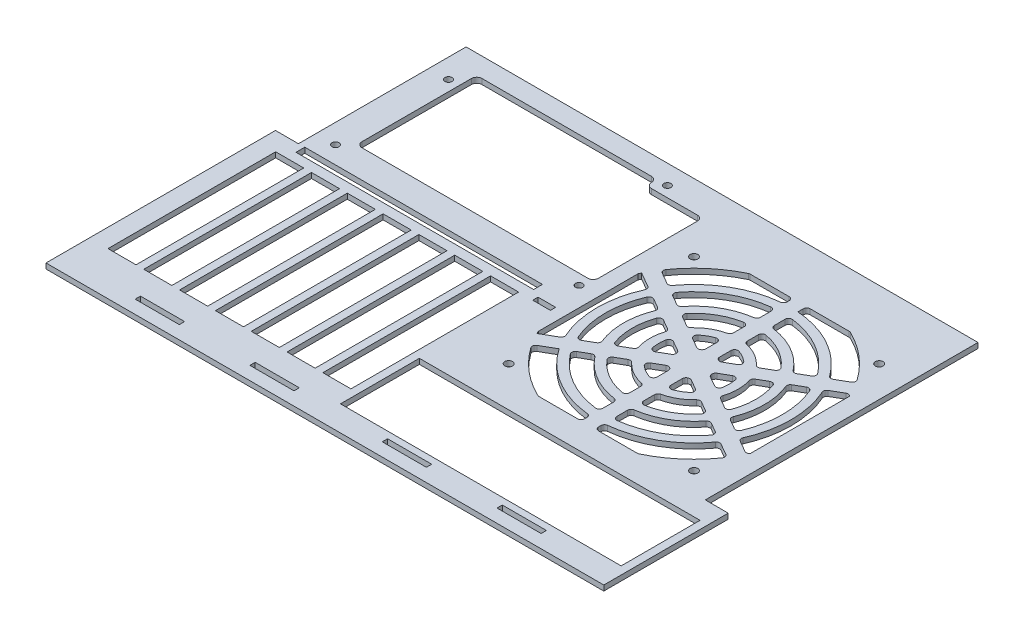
SolidWorks part; units mm, degrees
ref_plane "Front Plane" through (0, 0, 0) normal (0, 0, 1) x (1, 0, 0)
ref_plane "Top Plane" through (0, 0, 0) normal (0, 1, 0) x (1, 0, 0)
ref_plane "Right Plane" through (0, 0, 0) normal (1, 0, 0) x (0, 0, -1)
sketch "Sketch1" plane through (0, 0, 0) normal (0, 1, 0) x (1, 0, 0)
  line L0 (0, 0) -> (310, 0)
  line L1 (310, 0) -> (310, 225)
  line L2 (0, 0) -> (0, 225)
  line L3 (0, 225) -> (310, 225)
extrude "Boss-Extrude1" add sketch "Sketch1" along normal blind 3
sketch "Sketch2" plane through (0, 0, 0) normal (0, -1, 0) x (1, 0, 0)
  line L0 (0, 0) -> (0, -7.5) construction
  line L1 (0, -225) -> (0, 0) construction
  line L2 (0, -7.5) -> (40, -7.5) construction
  line L3 (40, -7.5) -> (65, -7.5) construction
  line L4 (65, -7.5) -> (105, -7.5) construction
  line L5 (270, -7.5) -> (310, -7.5) construction
  line L6 (310, 0) -> (310, -225) construction
  line L7 (105, -7.5) -> (130, -7.5) construction
  line L8 (130, -7.5) -> (180, -7.5) construction
  line L9 (180, -7.5) -> (205, -7.5) construction
  line L10 (205, -7.5) -> (245, -7.5) construction
  line L11 (245, -7.5) -> (270, -7.5) construction
  line L12 (40, -7.5) -> (65, -7.5)
  line L13 (65, -7.5) -> (65, -10.5)
  line L14 (65, -10.5) -> (40, -10.5)
  line L15 (40, -10.5) -> (40, -7.5)
  line L16 (105, -7.5) -> (130, -7.5)
  line L17 (130, -7.5) -> (130, -10.5)
  line L18 (130, -10.5) -> (105, -10.5)
  line L19 (105, -10.5) -> (105, -7.5)
  line L20 (180, -7.5) -> (205, -7.5)
  line L21 (205, -7.5) -> (205, -10.5)
  line L22 (205, -10.5) -> (180, -10.5)
  line L23 (180, -10.5) -> (180, -7.5)
  line L24 (245, -7.5) -> (245, -10.5)
  line L25 (245, -10.5) -> (270, -10.5)
  line L26 (270, -10.5) -> (270, -7.5)
  line L27 (270, -7.5) -> (245, -7.5)
  dimension "D1" = 40
  dimension "D2" = 40
  dimension "D3" = 25
  dimension "D4" = 25
  dimension "D5" = 50
  dimension "D6" = 25
  dimension "D7" = 40
  dimension "D8" = 25
extrude "Cut-Extrude1" cut sketch "Sketch2" against normal blind 3
sketch "Sketch4" plane through (0, 0, 0) normal (0, -1, 0) x (1, 0, 0)
  line L0 (270, -10.5) -> (310, -10.5) construction
  line L1 (310, 0) -> (310, -225) construction
  line L7 (310, -10.5) -> (310, -70.5) construction
  line L8 (310, -70.5) -> (300, -70.5)
  line L9 (300, -70.5) -> (300, -225)
  line L10 (310, -225) -> (0, -225) construction
  line L11 (300, -225) -> (310, -225)
  line L12 (310, -225) -> (310, -70.5)
extrude "Cut-Extrude3" cut sketch "Sketch4" against normal blind 10
sketch "Sketch5" plane through (310, 0, 0) normal (1, 0, 0) x (0, 0, -1)
  line L4 (0, 3) -> (0, 0)
  line L10 (0, 0) -> (70.5, 0)
  line L11 (70.5, 0) -> (70.5, 3)
  line L12 (70.5, 3) -> (0, 3)
extrude "Boss-Extrude2" add sketch "Sketch5" along normal blind 3
sketch "Sketch6" plane through (0, 3, 0) normal (0, 1, 0) x (1, 0, 0)
  line L0 (306, 16.5) -> (306, 10.5) construction
  line L1 (306, 10.5) -> (306, 0) construction
  line L2 (311, 16.5) -> (313, 16.5) construction
  line L3 (27.8, 24.6) -> (23.41, 24.6) construction
  line L4 (311, 16.5) -> (306, 16.5) construction
  line L5 (306, 16.5) -> (306, 14.29) construction
  line L6 (306, 14.29) -> (308.54, 14.29) construction
  line L7 (308.54, 14.29) -> (308.54, 58.99)
  line L8 (308.54, 58.99) -> (149.54, 58.99)
  line L9 (149.54, 58.99) -> (149.54, 14.29)
  line L10 (149.54, 14.29) -> (308.54, 14.29)
  line L11 (306, 16.5) -> (306, 18.1) construction
  line L12 (306, 18.1) -> (6, 18.1) construction
  line L13 (23.41, 24.6) -> (7.51, 24.6)
  line L14 (149.54, 58.99) -> (145.15, 58.99) construction
  line L15 (145.15, 18.1) -> (145.15, 24.6) construction
  line L16 (145.15, 24.6) -> (145.15, 119.6)
  line L17 (145.15, 119.6) -> (129.25, 119.6)
  line L18 (129.25, 119.6) -> (129.25, 24.6)
  line L19 (129.25, 24.6) -> (145.15, 24.6)
  line L20 (129.25, 24.6) -> (124.86, 24.6) construction
  line L21 (124.86, 24.6) -> (108.96, 24.6)
  line L22 (108.96, 24.6) -> (104.57, 24.6) construction
  line L23 (104.57, 24.6) -> (88.67, 24.6)
  line L24 (88.67, 24.6) -> (84.28, 24.6) construction
  line L25 (84.28, 24.6) -> (68.38, 24.6)
  line L26 (68.38, 24.6) -> (63.99, 24.6) construction
  line L27 (63.99, 24.6) -> (48.09, 24.6)
  line L28 (124.86, 24.6) -> (124.86, 119.6)
  line L29 (124.86, 119.6) -> (108.96, 119.6)
  line L30 (108.96, 119.6) -> (108.96, 24.6)
  line L31 (104.57, 24.6) -> (104.57, 119.6)
  line L32 (104.57, 119.6) -> (88.67, 119.6)
  line L33 (88.67, 119.6) -> (88.67, 24.6)
  line L34 (84.28, 24.6) -> (84.28, 119.6)
  line L35 (84.28, 119.6) -> (68.38, 119.6)
  line L36 (68.38, 119.6) -> (68.38, 24.6)
  line L37 (63.99, 24.6) -> (63.99, 119.6)
  line L38 (63.99, 119.6) -> (48.09, 119.6)
  line L39 (48.09, 119.6) -> (48.09, 24.6)
  line L40 (48.09, 24.6) -> (43.7, 24.6) construction
  line L41 (43.7, 24.6) -> (27.8, 24.6)
  line L42 (43.7, 24.6) -> (43.7, 119.6)
  line L43 (43.7, 119.6) -> (27.8, 119.6)
  line L44 (27.8, 119.6) -> (27.8, 24.6)
  line L45 (0, 0) -> (313, 0) construction
  line L46 (7.51, 24.6) -> (7.51, 119.6)
  line L47 (7.51, 119.6) -> (23.41, 119.6)
  line L48 (313, 70.5) -> (313, 0) construction
  line L49 (313, 16.5) -> (313, 0) construction
  line L50 (23.41, 119.6) -> (23.41, 24.6)
  line L51 (270, 10.5) -> (306, 10.5) construction
  dimension "D2" = 5
  dimension "D3" = 15.9
  dimension "D4" = 4.39
  dimension "D5" = 15.9
  dimension "D6" = 4.39
  dimension "D7" = 15.9
  dimension "D8" = 4.39
  dimension "D9" = 15.9
  dimension "D10" = 4.39
  dimension "D11" = 15.9
  dimension "D12" = 4.39
  dimension "D13" = 15.9
  dimension "D14" = 4.39
  dimension "D15" = 159
  dimension "D16" = 2.54
  dimension "D17" = 1.6
  dimension "D18" = 4.39
  dimension "D19" = 2
extrude "Cut-Extrude4" cut sketch "Sketch6" against normal blind 3
sketch "Sketch7" plane through (0, 0, 0) normal (0, -1, 0) x (1, 0, 0)
  line L0 (0, 0) -> (0, -130) construction
  line L1 (0, -225) -> (0, 0) construction
  line L2 (0, -130) -> (-3, -130)
  line L3 (-3, -130) -> (-3, 0)
  line L4 (-3, 0) -> (0, 0)
  line L5 (0, 0) -> (0, -130)
extrude "Boss-Extrude3" add sketch "Sketch7" against normal blind 3
sketch "Sketch8" plane through (0, 0, 0) normal (0, -1, 0) x (1, 0, 0)
  line L0 (0, -130) -> (10, -130)
  line L1 (10, -130) -> (10, -225)
  line L2 (300, -225) -> (0, -225) construction
  line L3 (10, -225) -> (0, -225)
  line L4 (0, -225) -> (0, -130)
extrude "Cut-Extrude5" cut sketch "Sketch8" against normal blind 3
sketch "Sketch9" plane through (0, 0, 0) normal (0, -1, 0) x (1, 0, 0)
  line L0 (10, -177.5) -> (15, -177.5) construction
  line L1 (10, -225) -> (10, -130) construction
  line L2 (165, -225) -> (165, -220) construction
  line L3 (300, -225) -> (10, -225) construction
  line L4 (165, -220) -> (15, -220) construction
  line L5 (15, -220) -> (15, -134) construction
  line L6 (15, -134) -> (165, -134) construction
  line L7 (165, -134) -> (165, -220) construction
  line L8 (15, -220) -> (21, -220) construction
  line L9 (21, -220) -> (21, -204) construction
  line L10 (21, -204) -> (21, -140) construction
  line L11 (159, -140) -> (21, -140) construction
  line L12 (21, -220) -> (135, -220) construction
  line L13 (135, -220) -> (135, -214) construction
  line L14 (90, -140) -> (90, -146) construction
  line L15 (21, -172) -> (27, -172) construction
  line L16 (90, -220) -> (90, -214) construction
  line L17 (135, -214) -> (129, -214) construction
  line L18 (135, -214) -> (135, -208) construction
  line L19 (90, -146) -> (27, -146)
  line L20 (27, -146) -> (27, -214)
  line L21 (27, -214) -> (129, -214)
  line L22 (129, -214) -> (129, -208)
  line L23 (165, -181.7713) -> (161, -181.7713) construction
  line L24 (161, -181.7713) -> (151.3672, -181.7713) construction
  line L25 (129, -208) -> (161, -208)
  line L26 (161, -208) -> (161, -146)
  line L27 (161, -146) -> (90, -146)
  circle A0 centre (21, -204) radius 2
  circle A1 centre (21, -140) radius 2
  circle A2 centre (159, -140) radius 2
  circle A3 centre (135, -214) radius 2
  dimension "D1" = 5
extrude "Cut-Extrude6" cut sketch "Sketch9" against normal blind 3
fillet "Fillet1" radius 3 6 edges at (27, 1.5, -146) (27, 1.5, -214) (161, 1.5, -208) (129, 1.5, -208) (129, 1.5, -214) (161, 1.5, -146)
sketch "Sketch10" plane through (0, 0, 0) normal (0, -1, 0) x (1, 0, 0)
  line L0 (300, -147.75) -> (290, -147.75) construction
  line L1 (300, -70.5) -> (300, -225) construction
  line L2 (235.3769, -225) -> (235.3769, -220) construction
  line L3 (300, -225) -> (10, -225) construction
  line L4 (240.7859, -58.99) -> (240.7859, -74.1135) construction
  line L5 (230, -123.99) -> (230, -125.4683)
  line L6 (308.54, -58.99) -> (149.54, -58.99) construction
  line L8 (290, -74.1135) -> (170, -74.1135) construction
  line L10 (290, -74.1135) -> (170, -194.1135) construction
  line L12 (290, -74.1135) -> (290, -81.6135) construction
  line L13 (290, -81.6135) -> (282.5, -81.6135) construction
  line L14 (290, -194.1135) -> (282.5006, -194.016) construction
  line L15 (282.5006, -194.016) -> (282.5006, -186.516) construction
  line L16 (170, -194.1135) -> (177.5, -194.1135) construction
  line L17 (177.5, -194.1135) -> (177.5, -186.6135) construction
  line L18 (170, -74.1135) -> (170, -81.6135) construction
  line L19 (170, -81.6135) -> (177.5, -81.6135) construction
  line L20 (282.5, -81.6135) -> (177.5, -186.6135) construction
  line L22 (230, -125.4683) -> (233.972, -125.4683)
  line L23 (230, -125.4683) -> (226.028, -125.4683)
  line L24 (226.028, -125.4683) -> (226.028, -67.9265)
  line L25 (233.972, -125.4683) -> (233.972, -67.9265)
  line L26 (233.972, -67.9265) -> (226.028, -67.9265)
  line L27 (239.4729, -133.2307) -> (289.3055, -104.4598)
  line L28 (289.3055, -104.4598) -> (285.3336, -97.5802)
  line L29 (235.501, -126.3511) -> (285.3336, -97.5802)
  line L30 (237.4869, -129.7909) -> (239.4729, -133.2307)
  line L31 (237.4869, -129.7909) -> (235.501, -126.3511)
  line L32 (235.501, -141.8759) -> (285.3336, -170.6467)
  line L33 (285.3336, -170.6467) -> (289.3055, -163.7671)
  line L34 (239.4729, -134.9962) -> (289.3055, -163.7671)
  line L35 (237.4869, -138.436) -> (235.501, -141.8759)
  line L36 (237.4869, -138.436) -> (239.4729, -134.9962)
  line L37 (226.028, -142.7586) -> (226.028, -200.3004)
  line L38 (226.028, -200.3004) -> (233.972, -200.3004)
  line L39 (233.972, -142.7586) -> (233.972, -200.3004)
  line L40 (230, -142.7586) -> (226.028, -142.7586)
  line L41 (230, -142.7586) -> (233.972, -142.7586)
  line L42 (220.5271, -134.9962) -> (170.6945, -163.7671)
  line L43 (170.6945, -163.7671) -> (174.6664, -170.6467)
  line L44 (224.499, -141.8759) -> (174.6664, -170.6467)
  line L45 (222.5131, -138.436) -> (220.5271, -134.9962)
  line L46 (222.5131, -138.436) -> (224.499, -141.8759)
  line L47 (224.499, -126.3511) -> (174.6664, -97.5802)
  line L48 (174.6664, -97.5802) -> (170.6945, -104.4598)
  line L49 (220.5271, -133.2307) -> (170.6945, -104.4598)
  line L50 (222.5131, -129.7909) -> (224.499, -126.3511)
  line L51 (222.5131, -129.7909) -> (220.5271, -133.2307)
  line L52 (290, -105.8914) -> (290, -162.3355)
  line L53 (258.2221, -74.1135) -> (201.7779, -74.1135)
  line L54 (170, -105.8914) -> (170, -162.3355)
  line L55 (258.7815, -193.99) -> (199.2185, -193.99)
  line L56 (170, -74.1135) -> (290, -194.1135) construction
  circle A0 centre (282.5, -81.6135) radius 2.2
  circle A1 centre (282.5006, -186.516) radius 2.2
  circle A2 centre (177.5, -186.6135) radius 2.2
  circle A3 centre (177.5, -81.6135) radius 2.2
  circle A4 centre (230, -134.1135) radius 10.1235
  circle A6 centre (230, -134.1135) radius 20
  circle A7 centre (230, -134.1135) radius 25
  circle A8 centre (230, -134.1135) radius 35
  circle A9 centre (230, -134.1135) radius 40
  circle A10 centre (230, -134.1135) radius 50
  circle A12 centre (230, -134.1135) radius 55
  circle A13 centre (230, -134.1135) radius 66.306
  point P71 (230, -134.1135)
  dimension "D4" = 6
  dimension "D1" = 10
  dimension "D2" = 120
  dimension "D3" = 120
  dimension "D5" = 120
  dimension "D6" = 120
  dimension "D7" = 120
extrude "Cut-Extrude7" cut sketch "Sketch10" against normal blind 10 contours A0 | A3 | L34 A13 L52 L27 A12 | L29 A13 L53 L25 A12 | L53 A13 L47 A12 L24 | L49 A13 L54 L42 A12 | L44 A13 L55 L37 A12 | L55 A13 L32 A12 L39 | L34 A10 L27 A9 | L29 A10 L25 A9 | L24 A10 L47 A9 | L49 A10 L42 A9 | L44 A10 L37 A9 | L39 A10 L32 A9 | L34 A8 L27 A7 | L39 A8 L32 A7 | L44 A8 L37 A7 | L49 A8 L42 A7 | L24 A8 L47 A7 | L29 A8 L25 A7 | L29 A6 L25 A4 | L34 A6 L27 A4 | L39 A6 L32 A4 | L44 A6 L37 A4 | L49 A6 L42 A4 | L24 A6 L47 A4 | A2 | A1
fillet "Fillet2" radius 2 98 edges at (184.479, 1.5, -164.9815) (197.5162, 1.5, -157.4544) (210.6103, 1.5, -149.8945) (226.028, 1.5, -158.7959) (226.028, 1.5, -173.9158) (226.028, 1.5, -188.9698) (174.6664, 1.5, -170.6467) (188.8216, 1.5, -162.4743) (201.8709, 1.5, -154.9402) (215.0105, 1.5, -147.3541) (226.028, 1.5, -153.7151) (226.028, 1.5, -168.8873) (226.028, 1.5, -183.9554) (226.028, 1.5, -193.99) (201.5169, 1.5, -193.99) (258.4831, 1.5, -193.99) (184.8496, 1.5, -155.5946) (197.8989, 1.5, -148.0606) (211.0385, 1.5, -140.4744) (193.5442, 1.5, -150.5748) (206.6384, 1.5, -143.0149) (180.507, 1.5, -158.1018) (184.8496, 1.5, -112.6323) (197.8989, 1.5, -120.1663) (211.0385, 1.5, -127.7525) (206.6384, 1.5, -125.212) (193.5442, 1.5, -117.6521) (180.507, 1.5, -110.1251) (226.028, 1.5, -99.3396) (226.028, 1.5, -84.2715) (226.028, 1.5, -74.1135) (201.8709, 1.5, -113.2867) (188.8216, 1.5, -105.7526) (201.7779, 1.5, -74.1135) (258.2221, 1.5, -74.1135) (174.6664, 1.5, -97.5802) (233.972, 1.5, -173.9158) (233.972, 1.5, -168.8873) (233.972, 1.5, -183.9554) (233.972, 1.5, -193.99) (258.1291, 1.5, -154.9402) (271.1784, 1.5, -162.4743) (285.3336, 1.5, -170.6467) (275.521, 1.5, -164.9815) (262.4838, 1.5, -157.4544) (249.3897, 1.5, -149.8945) (233.972, 1.5, -158.7959) (233.972, 1.5, -143.4252) (236.0782, 1.5, -142.2091) (223.9218, 1.5, -142.2091) (226.028, 1.5, -143.4252) (219.9499, 1.5, -132.8974) (219.9499, 1.5, -135.3295) (226.028, 1.5, -124.8017) (223.9218, 1.5, -126.0178) (210.6103, 1.5, -118.3324) (197.5162, 1.5, -110.7725) (226.028, 1.5, -79.2571) (226.028, 1.5, -94.3111) (226.028, 1.5, -109.431) (266.4558, 1.5, -150.5748) (279.493, 1.5, -158.1018) (290, 1.5, -162.3355) (290, 1.5, -105.8914) (289.3055, 1.5, -163.7671) (275.1504, 1.5, -155.5946) (262.1011, 1.5, -148.0606) (248.9615, 1.5, -140.4744) (248.9615, 1.5, -127.7525) (253.3616, 1.5, -143.0149) (240.0501, 1.5, -135.3295) (240.0501, 1.5, -132.8974) (253.3616, 1.5, -125.212) (262.1011, 1.5, -120.1663) (275.1504, 1.5, -112.6323) (266.4558, 1.5, -117.6521) (279.493, 1.5, -110.1251) (289.3055, 1.5, -104.4598) (262.4838, 1.5, -110.7725) (249.3897, 1.5, -118.3324) (258.1291, 1.5, -113.2867) (271.1784, 1.5, -105.7526) (244.9895, 1.5, -120.8728) (236.0782, 1.5, -126.0178) (233.972, 1.5, -114.5118) (233.972, 1.5, -99.3396) (233.972, 1.5, -84.2715) (233.972, 1.5, -124.8017) (233.972, 1.5, -109.431) (233.972, 1.5, -94.3111) (233.972, 1.5, -79.2571) (233.972, 1.5, -74.1135) (275.521, 1.5, -103.2454) (285.3336, 1.5, -97.5802) (215.0105, 1.5, -120.8728) (226.028, 1.5, -114.5118) (233.972, 1.5, -153.7151) (244.9895, 1.5, -147.3541)
sketch "Sketch11" plane through (0, 3, 0) normal (0, 1, 0) x (1, 0, 0)
  line L2 (13.51, 125.1) -> (148.15, 125.1)
  line L3 (148.15, 130.1) -> (13.51, 130.1)
  line L4 (132.25, 125.1) -> (148.15, 125.1) construction
  line L5 (148.15, 125.1) -> (148.15, 130.1)
  line L31 (7.51, 119.6) -> (7.51, 125.1) construction
  line L32 (7.51, 125.1) -> (13.51, 125.1) construction
  line L33 (13.51, 125.1) -> (13.51, 130.1)
extrude "Cut-Extrude8" cut sketch "Sketch11" against normal through all
sketch "Sketch13" plane through (0, 3, 0) normal (0, 1, 0) x (1, 0, 0)
  line L0 (148.15, 125.1) -> (148.15, 130.1) construction
  line L1 (148.15, 125.1) -> (153.15, 125.1) construction
  line L2 (145.15, 119.6) -> (153.15, 119.6) construction
  line L3 (153.15, 119.6) -> (153.15, 122.6) construction
  line L4 (153.15, 119.6) -> (163.15, 119.6)
  line L5 (163.15, 119.6) -> (163.15, 122.6)
  line L6 (163.15, 122.6) -> (153.15, 122.6)
  line L7 (153.15, 122.6) -> (153.15, 119.6)
extrude "Cut-Extrude9" cut sketch "Sketch13" against normal blind 3
